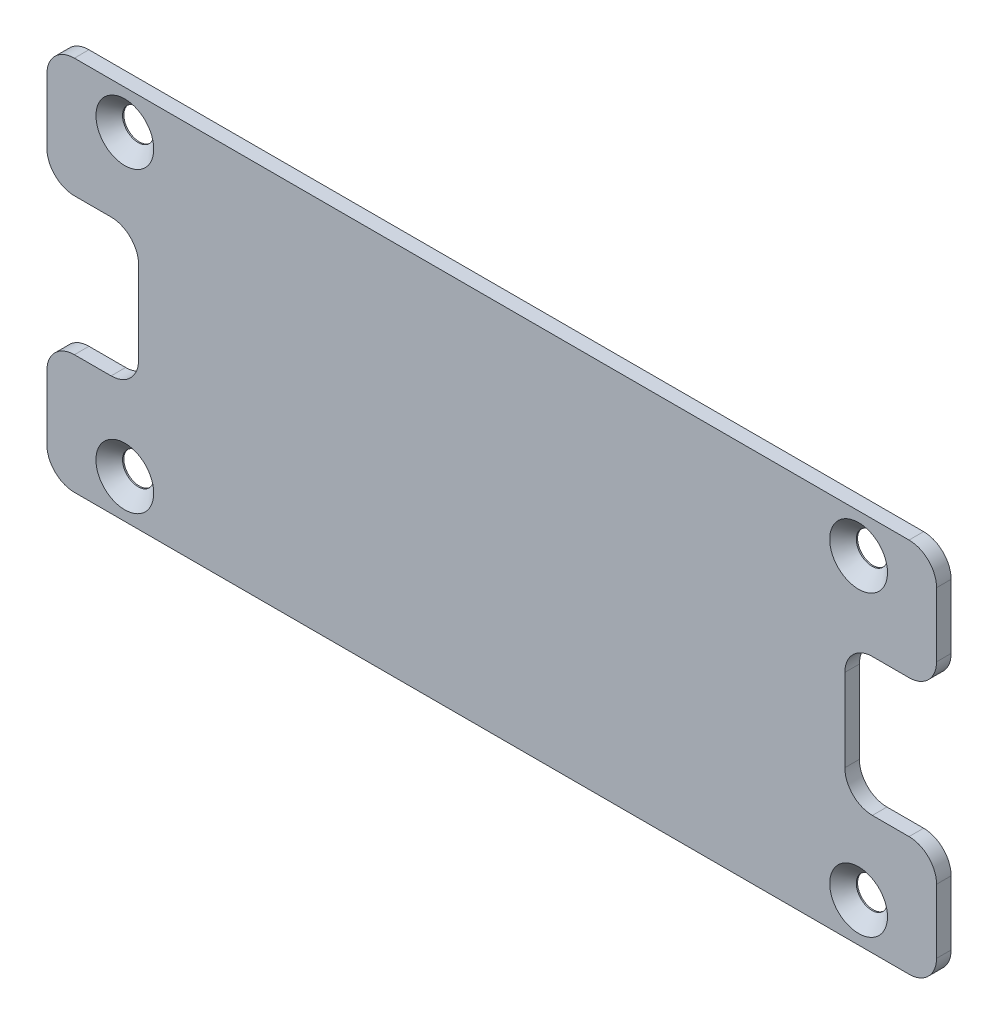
SolidWorks part; units mm, degrees
ref_plane "Front Plane" through (0, 0, 0) normal (0, 0, 1) x (1, 0, 0)
ref_plane "Top Plane" through (0, 0, 0) normal (0, 1, 0) x (1, 0, 0)
ref_plane "Right Plane" through (0, 0, 0) normal (1, 0, 0) x (0, 0, -1)
sketch "Sketch1" plane through (0, 0, 0) normal (0, 0, 1) x (1, 0, 0)
  line L4 (48.5, -17.5) -> (48.5, 17.5)
  line L5 (-45.5, -20.5) -> (45.5, -20.5)
  line L6 (-48.5, 17.5) -> (-48.5, -17.5)
  line L7 (45.5, 20.5) -> (-45.5, 20.5)
  line L20 (0, 0) -> (0, 20.5) construction
  line L21 (0, 0) -> (48.5, 0) construction
  arc A4 (45.5, -20.5) -> (48.5, -17.5) centre (45.5, -17.5) ccw
  arc A5 (-48.5, -17.5) -> (-45.5, -20.5) centre (-45.5, -17.5) ccw
  arc A6 (-45.5, 20.5) -> (-48.5, 17.5) centre (-45.5, 17.5) ccw
  arc A7 (48.5, 17.5) -> (45.5, 20.5) centre (45.5, 17.5) ccw
  dimension "D3" = 3
  dimension "D1" = 97
  dimension "D2" = 41
extrude "Boss-Extrude1" add sketch "Sketch1" along normal blind 1.5875
sketch "Sketch2" plane through (0, 0, 1.5875) normal (0, 0, 1) x (1, 0, 0)
  line L0 (0, 0) -> (0, 20.5) construction
  line L1 (45.5, 20.5) -> (-45.5, 20.5) construction
  line L2 (-48.5, 17.5) -> (-48.5, -17.5) construction
  line L3 (-48.5, 7.5) -> (-38.5, 7.5)
  line L4 (-48.5, 7.5) -> (-48.5, -7.5)
  line L5 (-48.5, -7.5) -> (-38.5, -7.5)
  line L6 (-38.5, 7.5) -> (-38.5, -7.5)
  line L7 (0, 0) -> (-38.5, 0) construction
  line L8 (38.5, 7.5) -> (38.5, -7.5)
  line L9 (48.5, -7.5) -> (38.5, -7.5)
  line L10 (48.5, 7.5) -> (48.5, -7.5)
  line L11 (48.5, 7.5) -> (38.5, 7.5)
  dimension "D1" = 15
  dimension "D2" = 10
extrude "Cut-Extrude1" cut sketch "Sketch2" against normal through all
hole_wizard "CSK for M3 Flat Head Machine Screw1" positions "Sketch4" profile "Sketch3" countersink size "M3" standard "ANSI Metric"
sketch "Sketch4" plane through (0, 0, 1.5875) normal (0, 0, 1) x (1, 0, 0)
  line L0 (0, 0) -> (0, 20.5) construction
  line L1 (45.5, 20.5) -> (-45.5, 20.5) construction
  line L3 (0, 0) -> (-38.5, 0) construction
  line L4 (-38.5, -7.5) -> (-38.5, 7.5) construction
  point P0 (-40, 16.25)
  point P15 (40, 16.25)
  point P17 (40, -16.25)
  point P18 (-40, -16.25)
  dimension "D1" = 80
  dimension "D2" = 32.5
sketch "Sketch3" plane through (-40, 16.25, 1.5875) normal (1, 0, 0) x (0, -1, 0)
  line L0 (0, 0) -> (0, 1.5875)
  line L1 (0, 1.5875) -> (1.7, 1.5875)
  line L2 (1.7, 1.5875) -> (1.7, 1.45)
  line L3 (1.7, 1.45) -> (3.15, 0)
  line L5 (3.15, 0) -> (0, 0)
  line L6 (-1.7, 1.45) -> (-3.15, 0) construction
  line L11 (0, -6.35) -> (0, 107.95) construction
  dimension "Thru Hole Dia." = 3.4
  dimension "Thru Hole Depth" = 1.5875
  dimension "Near C'Sink Dia." = 6.3
  dimension "Near C'Sink Angle" = 90
fillet "Fillet1" radius 3 8 edges at (-38.5, -7.5, 0.7937) (-38.5, 7.5, 0.7937) (38.5, 7.5, 0.7937) (38.5, -7.5, 0.7937) (48.5, -7.5, 0.7937) (48.5, 7.5, 0.7937) (-48.5, -7.5, 0.7937) (-48.5, 7.5, 0.7937)
